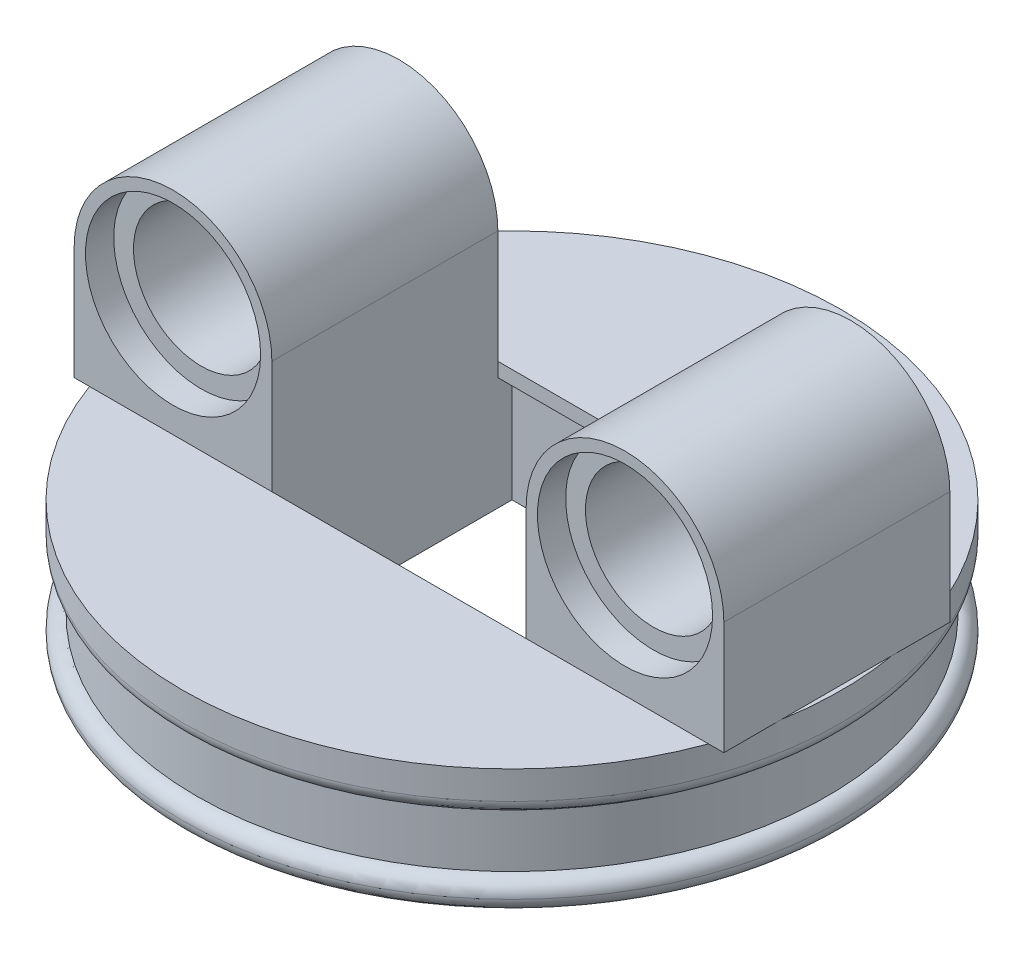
SolidWorks part; units mm, degrees
ref_plane "Front Plane" through (0, 0, 0) normal (0, 0, 1) x (1, 0, 0)
ref_plane "Top Plane" through (0, 0, 0) normal (0, 1, 0) x (1, 0, 0)
ref_plane "Right Plane" through (0, 0, 0) normal (1, 0, 0) x (0, 0, -1)
sketch "Sketch6" plane through (0, 0, 0) normal (0, 0, 1) x (1, 0, 0)
  line L1 (-11.5, 4) -> (-11.5, 0)
  line L3 (-4.5, 4) -> (-4.5, 0)
  line L4 (4.5, 4) -> (4.5, 0)
  line L5 (11.5, 4) -> (11.5, 0)
  line L6 (-11.5, 0) -> (-4.5, 0)
  line L7 (4.5, 0) -> (11.5, 0)
  arc A4 (-11.5, 4) -> (-4.5, 4) centre (-8, 4) cw
  arc A5 (4.5, 4) -> (11.5, 4) centre (8, 4) cw
extrude "Boss-Extrude1" add sketch "Sketch6" along normal mid plane 8
sketch "Sketch7" plane through (0, 0, 4) normal (0, 0, 1) x (1, 0, 0)
  circle A2 centre (-8, 4) radius 2.4
  dimension "D3" = 4.8
extrude "Cut-Extrude1" cut sketch "Sketch7" against normal blind 8 contours A2
sketch "Sketch8" plane through (0, 0, 4) normal (0, 0, 1) x (1, 0, 0)
  circle A0 centre (-8, 4) radius 3.1
  dimension "D1" = 6.2
extrude "Cut-Extrude2" cut sketch "Sketch8" against normal blind 1
mirror "Mirror1" about plane through (0, 0, 0) normal (0, 0, 1) of "Cut-Extrude2"
sketch "Sketch9" plane through (0, 0, 4) normal (0, 0, 1) x (1, 0, 0)
  circle A2 centre (8, 4) radius 2.4
  dimension "D2" = 4.8
extrude "Cut-Extrude3" cut sketch "Sketch9" against normal blind 8
sketch "Sketch10" plane through (0, 0, 4) normal (0, 0, 1) x (1, 0, 0)
  circle A0 centre (8, 4) radius 3.1
  dimension "D1" = 6.2
extrude "Cut-Extrude4" cut sketch "Sketch10" against normal blind 1
mirror "Mirror3" about plane through (0, 0, 0) normal (0, 0, 1) of "Cut-Extrude4"
sketch "Sketch11" plane through (0, 0, 0) normal (0, 1, 0) x (1, 0, 0)
  circle A0 centre (0, 0) radius 11.665
  dimension "D1" = 23.33
extrude "Boss-Extrude2" add sketch "Sketch11" against normal blind 0.5
sketch "Sketch13" plane through (0, -0.5, 0) normal (0, -1, 0) x (1, 0, 0)
  circle A2 centre (0, 0) radius 10.665
  circle A3 centre (0, 0) radius 11.665
extrude "Boss-Extrude3" add sketch "Sketch13" along normal blind 1
sketch "Sketch14" plane through (0, -1.5, 0) normal (0, -1, 0) x (1, 0, 0)
  circle A0 centre (0, 0) radius 10.665
  circle A1 centre (0, 0) radius 11.165
extrude "Boss-Extrude4" add sketch "Sketch14" along normal blind 2
sketch "Sketch15" plane through (0, -3.5, 0) normal (0, -1, 0) x (1, 0, 0)
  circle A0 centre (0, 0) radius 11.665
  circle A1 centre (0, 0) radius 10.665
extrude "Boss-Extrude5" add sketch "Sketch15" along normal blind 1
fillet "Fillet1" radius 0.5 1 edges at (0, -3.5, -11.665)
fillet "Fillet2" radius 0.5 1 edges at (0, -4.5, -11.665)
fillet "Fillet3" radius 0.5 1 edges at (0, -1.5, -11.665)
sketch "Sketch16" plane through (0, 0, 0) normal (0, 1, 0) x (1, 0, 0)
  line L0 (4.5, 4) -> (4.5, -4)
  line L1 (4.5, -4) -> (-4.5, -4)
  line L2 (-4.5, -4) -> (-4.5, 4)
  line L3 (-4.5, 4) -> (4.5, 4)
extrude "Cut-Extrude5" cut sketch "Sketch16" against normal blind 0.5
ref_plane "Plane1" through (4.5, -0.5, 4) normal (1, 0, 0) x (0, 0, -1)
sketch "Sketch18" plane through (0, -0.5, 0) normal (0, -1, 0) x (1, 0, 0)
  line L0 (-4.5, -4.5) -> (-4.5, 4.5)
  line L2 (-4.5, 4.5) -> (4.5, 4.5)
  line L3 (4.5, 1.525) -> (4.5, 6.475) construction
  line L4 (-4.5, -4.5) -> (4.5, -4.5)
  line L5 (4.5, -4.5) -> (4.5, 4.5)
  line L15 (-5, 5) -> (-5, -5)
  line L16 (-5, -5) -> (5, -5)
  line L17 (5, -5) -> (5, 5)
  line L18 (5, 5) -> (-5, 5)
  point P3 (-4.5, 0)
  dimension "D1" = 9
extrude "Boss-Extrude6" add sketch "Sketch18" along normal blind 4
